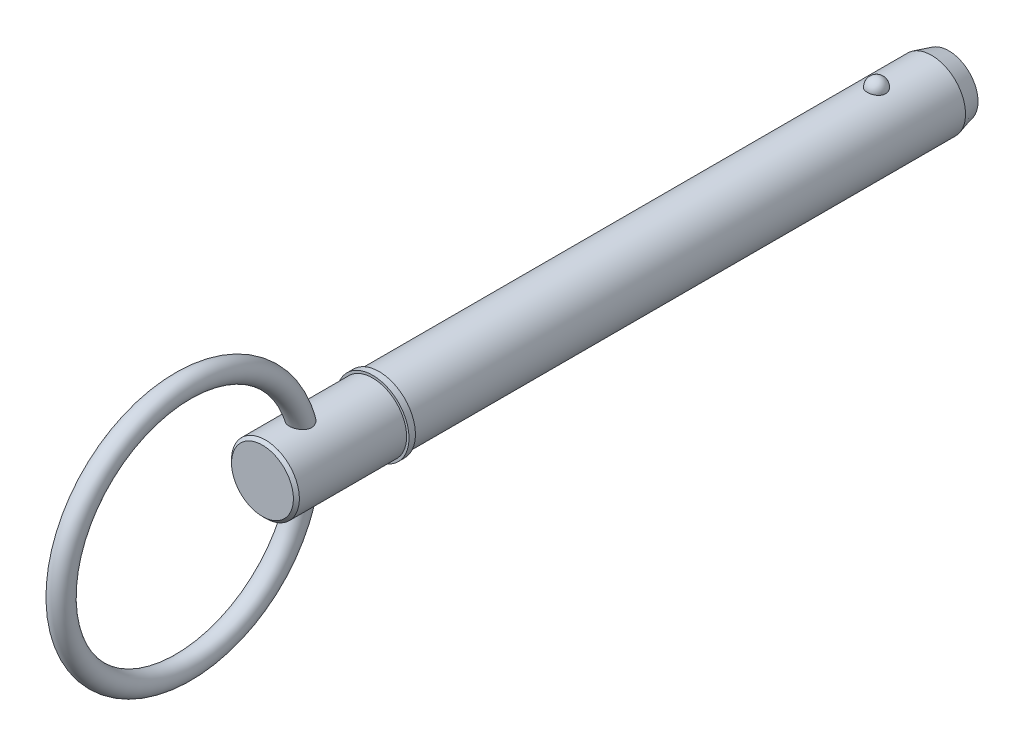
SolidWorks part; units mm, degrees
ref_plane "Front Plane" through (0, 0, 0) normal (0, 0, 1) x (1, 0, 0)
ref_plane "Top Plane" through (0, 0, 0) normal (0, 1, 0) x (1, 0, 0)
ref_plane "Right Plane" through (0, 0, 0) normal (1, 0, 0) x (0, 0, -1)
sketch "Sketch2" plane through (0, 0, 0) normal (0, 0, 1) x (1, 0, 0)
  circle A0 centre (0, 0) radius 7.94
  point P3 (0, 7.94)
  dimension "D1" = 15.88
extrude "Boss-Extrude1" add sketch "Sketch2" along normal blind 114.3
sketch "Sketch3" plane through (0, 0, 0) normal (0, 0, -1) x (-1, 0, 0)
  circle A0 centre (0, 0) radius 7.94
  dimension "D1" = 15.88
extrude "Boss-Extrude2" add sketch "Sketch3" along normal blind 19.05
chamfer "Chamfer1" distance 4 angle 15 1 edges at (-7.94, 0, -19.05)
sketch "Sketch18" plane through (0, 0, 0) normal (1, 0, 0) x (0, 0, -1)
  line L0 (15.05, 7.94) -> (-114.3, 7.94) construction
  line L1 (2.15, 10.09) -> (2.15, 5.79)
  line L2 (-114.3, -7.94) -> (15.05, -7.94) construction
  arc A0 (2.15, 10.09) -> (2.15, 5.79) centre (2.15, 7.94) ccw
  point P4 (0, 7.94)
  dimension "D1" = 18.03
revolve "Revolve1" add sketch "Sketch18" angle 360 about L1
sketch "Sketch19" plane through (0, 0, 0) normal (1, 0, 0) x (0, 0, -1)
  line L0 (-33.7288, 0) -> (-46.4542, 0) construction
sketch "Sketch20" plane through (0, 0, 0) normal (1, 0, 0) x (0, 0, -1)
  line L0 (-114.3, 0) -> (-114.3, 8.5)
  line L1 (-114.3, 7.94) -> (-114.3, -7.94) construction
  line L2 (-114.3, 8.5) -> (-115.8, 8.5)
  line L3 (-115.8, 8.5) -> (-115.8, 0)
  line L4 (-33.7288, 0) -> (-46.4542, 0) construction
  line L5 (-115.8, 0) -> (-114.3, 0)
  dimension "D1" = 8.5
  dimension "D2" = 1.5
revolve "Revolve2" add sketch "Sketch20" angle 360 about L0
sketch "Sketch21" plane through (0, 0, 114.3) normal (0, 0, -1) x (-1, 0, 0)
  circle A0 centre (0, 0) radius 7.94
  dimension "D1" = 15.88
extrude "Boss-Extrude3" add sketch "Sketch21" against normal blind 27.31
chamfer "Chamfer2" distance 0.7 angle 45 1 edges at (-7.94, 0, 141.61)
sketch "Sketch23" plane through (0, 0, 0) normal (1, 0, 0) x (0, 0, -1)
  line L0 (-141.61, 7.24) -> (-141.61, -7.24) construction
  circle A0 centre (-160.185, 0) radius 28.575
  point P2 (-131.61, 0)
  dimension "D1" = 57.15
  dimension "D2" = 10
sketch "Sketch24" plane through (0, 0, 0) normal (0, 1, 0) x (1, 0, 0)
  circle A0 centre (0, -131.61) radius 2.5
  dimension "D1" = 5
sweep "Sweep1" add profiles "Sketch24" path "Sketch23"
